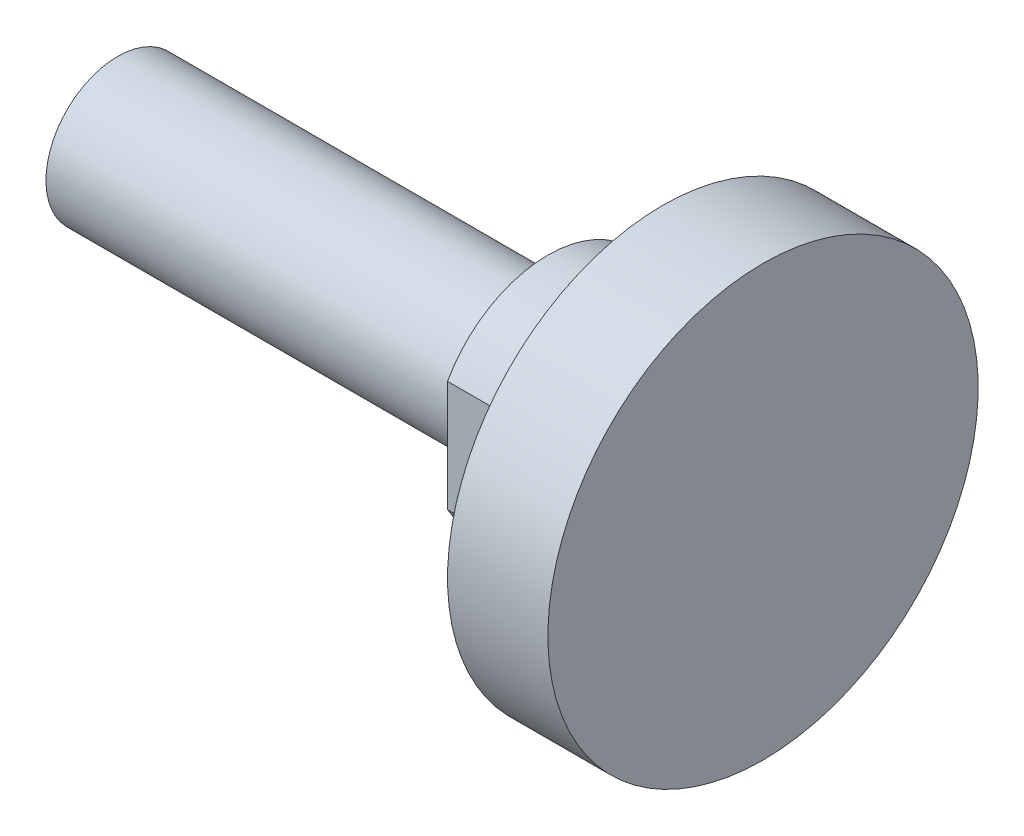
SolidWorks part; units mm, degrees
ref_plane "前基準面" through (0, 0, 0) normal (0, 0, 1) x (1, 0, 0)
ref_plane "上基準面" through (0, 0, 0) normal (0, 1, 0) x (1, 0, 0)
ref_plane "右基準面" through (0, 0, 0) normal (1, 0, 0) x (0, 0, -1)
sketch "草圖1" plane through (0, 0, 0) normal (0, 0, 1) x (1, 0, 0)
  line L0 (0, 0) -> (30, 0)
  line L1 (30, 0) -> (30, 3)
  line L2 (30, 3) -> (38, 3)
  line L3 (38, 3) -> (38, 10)
  line L4 (38, 10) -> (45, 10)
  line L5 (45, 10) -> (45, -5)
  line L6 (45, -5) -> (0, -5)
  line L7 (0, -5) -> (0, 0)
  dimension "D1" = 5
  dimension "D2" = 8
  dimension "D3" = 15
  dimension "D4" = 45
  dimension "D5" = 30
  dimension "D6" = 8
revolve "旋轉1" add sketch "草圖1" angle 360 about L6
sketch "草圖2" plane through (30, 0, 0) normal (-1, 0, 0) x (0, 0, 1)
  line L1 (-11.6638, 2.6693) -> (-7, 2.6693)
  line L2 (-11.6638, 2.6693) -> (-11.6638, -10.9074)
  line L3 (-11.6638, -10.9074) -> (-7, -10.9074)
  line L4 (-7, 2.6693) -> (-7, -10.9074)
  line L5 (7, 2.6693) -> (11.6638, 2.6693)
  line L6 (7, 2.6693) -> (7, -10.9074)
  line L7 (7, -10.9074) -> (11.6638, -10.9074)
  line L8 (11.6638, 2.6693) -> (11.6638, -10.9074)
  circle A0 centre (0, -5) radius 8 construction
  circle A1 centre (0, -5) radius 8 construction
  dimension "D1" = 7
  dimension "D2" = 7
extrude "除料-伸長1" cut sketch "草圖2" against normal blind 8
